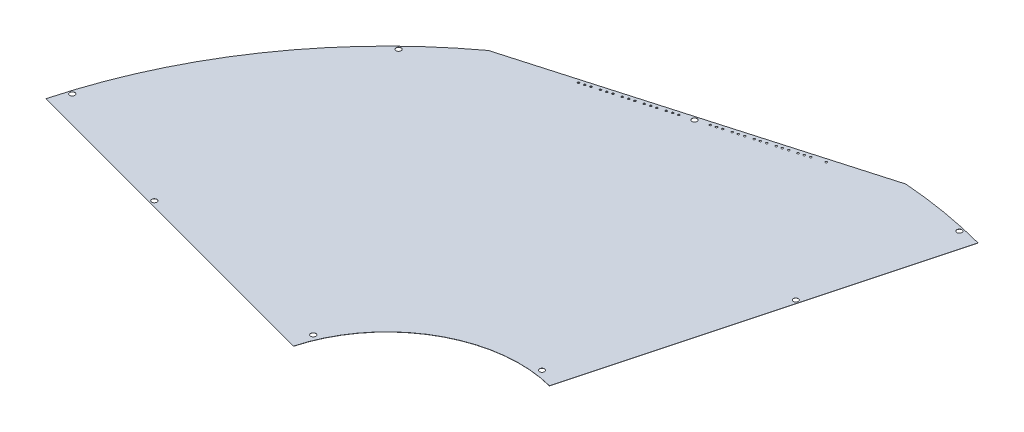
SolidWorks part; units mm, degrees
ref_plane "Front Plane" through (0, 0, 0) normal (0, 0, 1) x (1, 0, 0)
ref_plane "Top Plane" through (0, 0, 0) normal (0, 1, 0) x (1, 0, 0)
ref_plane "Right Plane" through (0, 0, 0) normal (1, 0, 0) x (0, 0, -1)
sketch "Sketch1" plane through (0, 0, 0) normal (0, 1, 0) x (1, 0, 0)
  line B0 (29.5284, 379.854) -> (-226.3334, 306.4868)
  line B1 (-101.2917, 27.6587) -> (-367.888, 99.0929)
  line B2 (26.6927, 101.5505) -> (98.127, 368.1468)
  arc B3 (29.5284, 379.854) -> (98.127, 368.1468) centre (0, 0) cw
  arc B4 (-367.888, 99.0929) -> (-226.3334, 306.4868) centre (0, 0) cw
  arc B5 (-101.2917, 27.6587) -> (26.6927, 101.5505) centre (0, 0) cw
  circle B6 centre (-360.8012, 112.7232) radius 2
  circle B7 centre (-262.5809, 271.9104) radius 2
  circle B8 centre (-101.18, 43.1579) radius 2
  circle B9 centre (-97.5756, 340.2866) radius 2
  circle B10 centre (13.2142, 109.2034) radius 2
  circle B11 centre (82.7795, 368.8246) radius 2
  circle B12 centre (65.3116, 257.2693) radius 2
  circle B13 centre (-255.4575, 72.0731) radius 2
sketch_block_instance "Quadrant Outer Profile with Gap-1"
sketch_block "Quadrant Outer Profile with Gap" parameters "D2"=381, "D3"=105, "D1"=31, "D4"=16, "D5"=357
sketch_block_instance "Hole Pin Locations-1"
sketch_block "Hole Pin Locations" parameters "D1"=4, "D10"=378, "D11"=110, "D2"=31, "D3"=3.5, "D4"=15.5, "D5"=15.5, "D6"=15.5, "D7"=3.5, "D8"=15.5, "D9"=354, "D12"=59, "D13"=265.43, "D14"=265.43, "D15"=16
extrude "Extrude1" add sketch "Sketch1" along normal blind 0.13
sketch "Sketch3" plane through (0, 0, 0) normal (0, -1, 0) x (1, 0, 0)
  line L0 (29.5284, -379.854) -> (-226.3334, -306.4868) construction
  circle B0 centre (-107.1882, -337.5303) radius 0.75
  circle B1 centre (-120.6459, -333.6713) radius 0.75
  circle B2 centre (-124.491, -332.5688) radius 0.75
  circle B3 centre (-111.0333, -336.4277) radius 0.75
  circle B4 centre (-114.8783, -335.3252) radius 0.75
  circle B5 centre (-128.336, -331.4662) radius 0.75
  circle B6 centre (-134.1036, -329.8124) radius 0.75
  circle B7 centre (-137.9486, -328.7099) radius 0.75
  circle B8 centre (-141.7937, -327.6073) radius 0.75
  circle B9 centre (-147.5612, -325.9535) radius 0.75
  circle B10 centre (-151.4063, -324.8509) radius 0.75
  circle B11 centre (-155.2513, -323.7484) radius 0.75
  circle B12 centre (-161.0189, -322.0946) radius 0.75
  circle B13 centre (-164.8639, -320.992) radius 0.75
  circle B14 centre (-168.709, -319.8895) radius 0.75
  circle B15 centre (-26.4423, -360.6838) radius 0.75
  circle B16 centre (-30.2873, -359.5813) radius 0.75
  circle B17 centre (-34.1324, -358.4787) radius 0.75
  circle B18 centre (-39.8999, -356.8249) radius 0.75
  circle B19 centre (-43.745, -355.7223) radius 0.75
  circle B20 centre (-47.59, -354.6198) radius 0.75
  circle B21 centre (-53.3576, -352.966) radius 0.75
  circle B22 centre (-57.2026, -351.8634) radius 0.75
  circle B23 centre (-61.0477, -350.7609) radius 0.75
  circle B24 centre (-66.8152, -349.107) radius 0.75
  circle B25 centre (-80.2729, -345.2481) radius 0.75
  circle B26 centre (-84.118, -344.1456) radius 0.75
  circle B27 centre (-70.6603, -348.0045) radius 0.75
  circle B28 centre (-74.5053, -346.9019) radius 0.75
  circle B29 centre (-87.963, -343.043) radius 0.75
  circle B30 centre (-16.8296, -363.4402) radius 0.75
sketch_block_instance "SIMM Pin Locations-1"
sketch_block "Block1" parameters "D4"=1.5, "D5"=1.5, "D1"=31, "D2"=354, "D3"=10, "D6"=84
extrude "Extrude2" cut sketch "Sketch3" against normal through all
